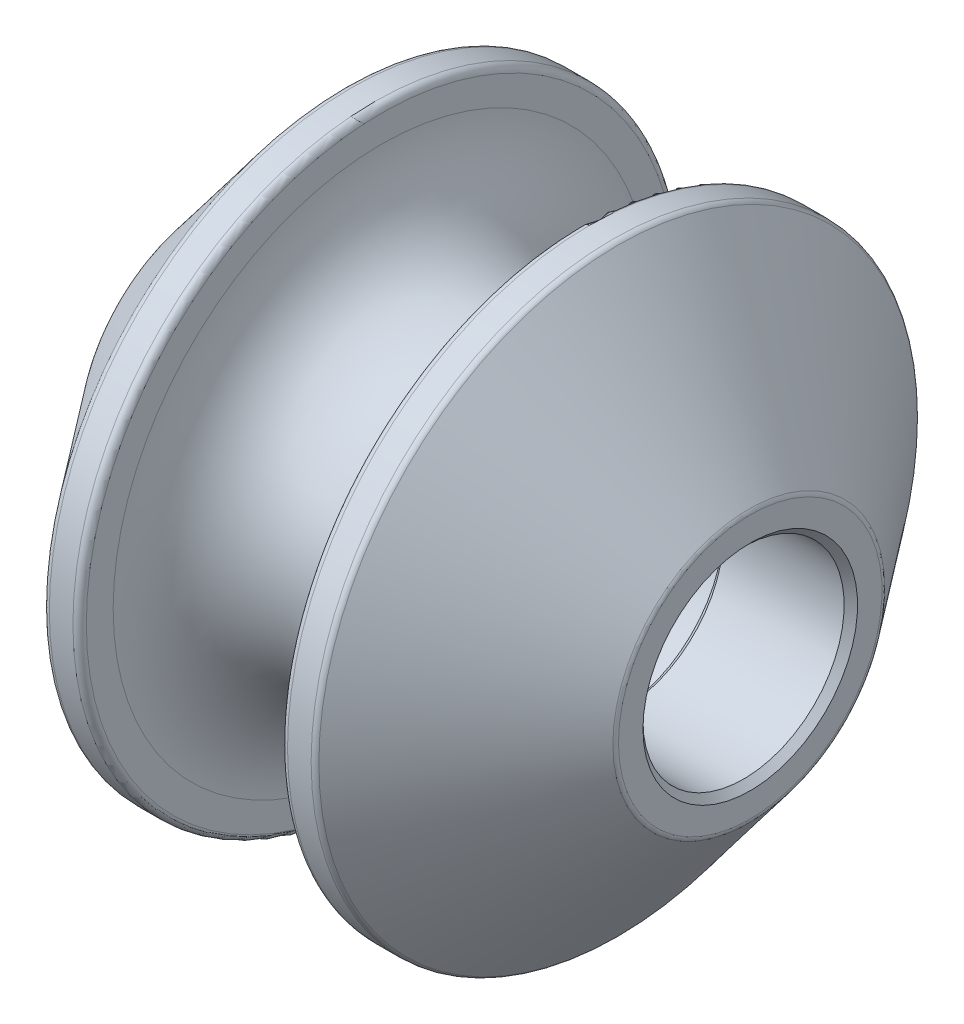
SolidWorks part; units mm, degrees
ref_plane "Front Plane" through (0, 0, 0) normal (0, 0, 1) x (1, 0, 0)
ref_plane "Top Plane" through (0, 0, 0) normal (0, 1, 0) x (1, 0, 0)
ref_plane "Right Plane" through (0, 0, 0) normal (1, 0, 0) x (0, 0, -1)
sketch "Sketch1" plane through (0, 0, 0) normal (0, 0, 1) x (1, 0, 0)
  line L0 (-40, 0) -> (40, 0) construction
  line L1 (-40, 15) -> (-20, 15)
  line L2 (40, 15) -> (40, 20)
  line L7 (-40, 20) -> (-40, 15)
  line L8 (0, 40) -> (0, 0) construction
  line L9 (-20, 15) -> (-20, 16)
  line L10 (-20, 16) -> (20, 16)
  line L11 (20, 16) -> (20, 15)
  line L12 (20, 15) -> (40, 15)
  line L13 (-15, 40) -> (-15, 45)
  line L14 (-15, 45) -> (-20, 45)
  line L15 (-20, 45) -> (-40, 20)
  line L16 (15, 40) -> (15, 45)
  line L17 (15, 45) -> (20, 45)
  line L18 (20, 45) -> (40, 20)
  arc A0 (15, 40) -> (-15, 40) centre (0, 40) cw
  dimension "D2" = 15
  dimension "D1" = 80
  dimension "D3" = 30
  dimension "D4" = 80
  dimension "D5" = 5
  dimension "D6" = 40
  dimension "D7" = 20
  dimension "D8" = 1
  dimension "D9" = 5
revolve "Revolve1" add sketch "Sketch1" angle 360 about L0
chamfer "Chamfer1" distance 1 angle 45 4 edges at (-40, 0, 15) (-20, 0, 15) (20, 0, 15) (40, 0, 15)
fillet "Fillet1" radius 1 6 edges at (40, 0, 20) (20, 0, 45) (-20, 0, 45) (-40, 0, 20) (15, 0, 45) (-15, 0, 45)
